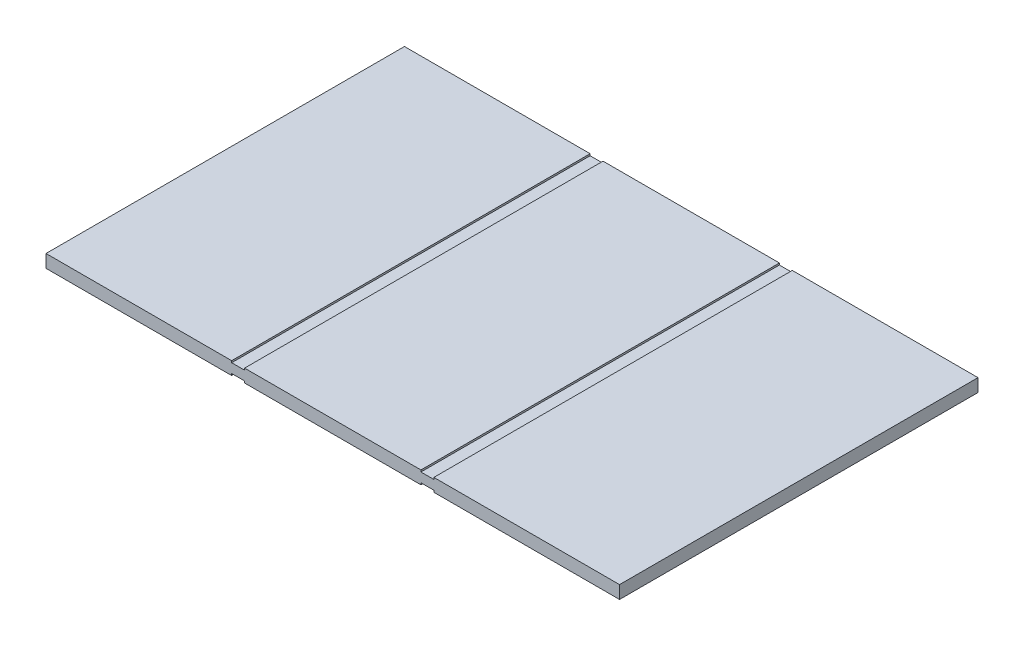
SolidWorks part; units mm, degrees
ref_plane "Plano frontal" through (0, 0, 0) normal (0, 0, 1) x (1, 0, 0)
ref_plane "Plano superior" through (0, 0, 0) normal (0, 1, 0) x (1, 0, 0)
ref_plane "Plano direito" through (0, 0, 0) normal (1, 0, 0) x (0, 0, -1)
sketch "Esboço1" plane through (0, 0, 0) normal (0, 1, 0) x (1, 0, 0)
  line L0 (0, -1000) -> (0, 49000) construction
  line L1 (-1000, 0) -> (49000, 0) construction
  line L2 (-1000, 250) -> (49000, 250) construction
  line L3 (-1000, -250) -> (49000, -250) construction
  line L4 (400, -1000) -> (400, 49000) construction
  line L5 (-400, -1000) -> (-400, 49000) construction
  line L7 (-400, 250) -> (400, 250)
  line L8 (-400, 250) -> (-400, -250)
  line L9 (-400, -250) -> (400, -250)
  line L10 (400, 250) -> (400, -250)
  dimension "D1" = 250
  dimension "D2" = 250
  dimension "D3" = 400
  dimension "D4" = 400
extrude "Ressalto-extrusão1" add sketch "Esboço1" along normal blind 18
sketch "Esboço2" plane through (0, 18, 0) normal (0, 1, 0) x (1, 0, 0)
  line L0 (-400.0211, -896.6278) -> (-400.0211, 49103.3722) construction
  line L2 (0, -1000) -> (0, 49000) construction
  line L3 (400, -1000) -> (400, 49000) construction
  line L4 (400, -250) -> (400, 250) construction
  line L5 (-387.0211, -896.6278) -> (-387.0211, 49103.3722) construction
  line L6 (-141.0211, -896.6278) -> (-141.0211, 49103.3722) construction
  line L7 (-123.0211, -896.6278) -> (-123.0211, 49103.3722) construction
  line L8 (122.9789, -896.6278) -> (122.9789, 49103.3722) construction
  line L9 (140.9789, -896.6278) -> (140.9789, 49103.3722) construction
  line L10 (-1313.712, 250) -> (48686.288, 250) construction
  line L12 (-1258.8798, -250) -> (48741.1202, -250) construction
  line L14 (-400, -250) -> (400, -250) construction
  line L15 (-141.0211, 250) -> (-123.0211, 250)
  line L16 (-141.0211, 250) -> (-141.0211, -250)
  line L17 (-141.0211, -250) -> (-123.0211, -250)
  line L18 (-123.0211, 250) -> (-123.0211, -250)
  line L19 (122.9789, 250) -> (140.9789, 250)
  line L20 (122.9789, 250) -> (122.9789, -250)
  line L21 (122.9789, -250) -> (140.9789, -250)
  line L22 (140.9789, 250) -> (140.9789, -250)
  point P10 (400, 0)
  point P32 (-141.0211, -250)
  dimension "D4" = 246
  dimension "D1" = 13
  dimension "D2" = 246
  dimension "D3" = 18
  dimension "D5" = 18
extrude "Corte-extrusão1" cut sketch "Esboço2" against normal blind 2.5
sketch "Esboço3" plane through (0, 0, 0) normal (0, -1, 0) x (1, 0, 0)
  line L0 (-400, 250) -> (400, 250) construction
  line L1 (-141, 250) -> (-123.0211, 250)
  line L2 (-141, 250) -> (-141, -250)
  line L3 (-141, -250) -> (-123.0211, -250)
  line L4 (-123.0211, 250) -> (-123.0211, -250)
  line L5 (122.9789, 250) -> (140.9789, 250)
  line L6 (122.9789, 250) -> (122.9789, -250)
  line L7 (122.9789, -250) -> (140.9789, -250)
  line L8 (140.9789, 250) -> (140.9789, -250)
  point P12 (-123.0211, 250)
  point P15 (-141, 250)
extrude "Corte-extrusão2" cut sketch "Esboço3" against normal blind 2.5
